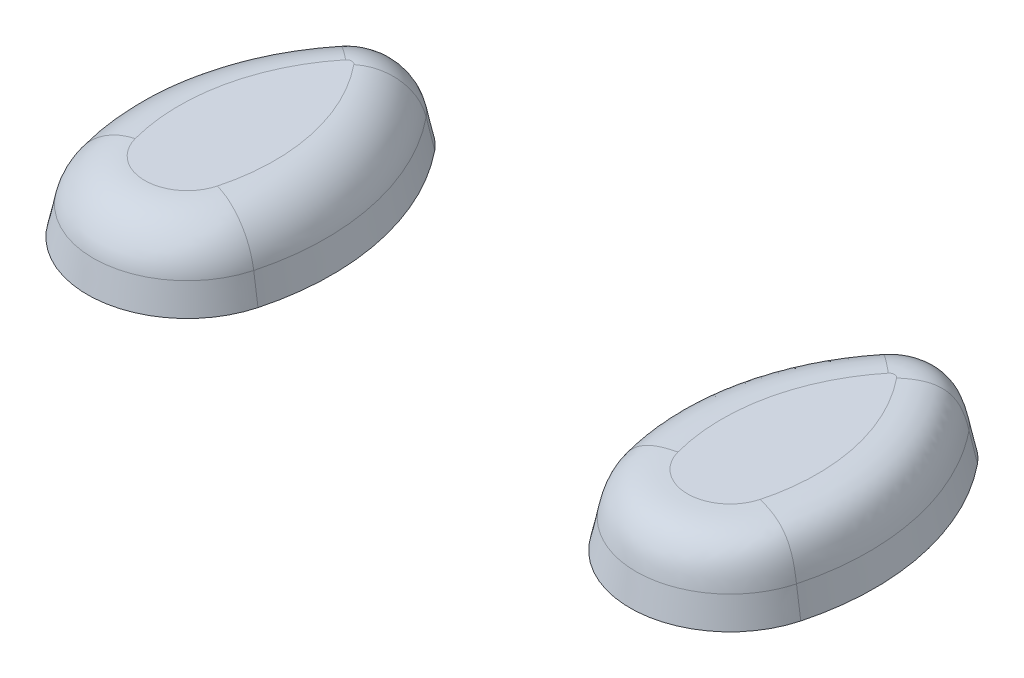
SolidWorks part; units mm, degrees
ref_plane "Front Plane" through (0, 0, 0) normal (0, 0, 1) x (1, 0, 0)
ref_plane "Top Plane" through (0, 0, 0) normal (0, 1, 0) x (1, 0, 0)
ref_plane "Right Plane" through (0, 0, 0) normal (1, 0, 0) x (0, 0, -1)
sketch "Sketch1" plane through (0, 0, 0) normal (0, 1, 0) x (1, 0, 0)
  line L0 (0, 0) -> (0, 69.4951) construction
  arc A0 (-17.6789, 44.5379) -> (17.6789, 44.5379) centre (0, 30.2081) cw
  arc A1 (17.6789, 44.5379) -> (34.9951, -36.8109) centre (-53.4568, -13.1217) cw
  arc A2 (34.9951, -36.8109) -> (-34.9951, -36.8109) centre (0, -27.4385) cw
  arc A3 (-17.6789, 44.5379) -> (-34.9951, -36.8109) centre (53.4568, -13.1217) ccw
extrude "Extrude1" add sketch "Sketch1" along normal blind 25.4 draft 12
ref_plane "Plane1" through (-98.3197, 0, 0) normal (1, 0, 0) x (0, 0, -1)
mirror "Mirror2" about plane through (-98.3197, 0, 0) normal (1, 0, 0)
fillet "Fillet2" radius 19.05 4 edges at (-227.4646, 25.4, -4.8188) (-196.6394, 25.4, -47.5663) (-165.8142, 25.4, -4.8188) (-196.6394, 25.4, 58.2681)
fillet "Fillet3" radius 19.05 8 edges at (30.8252, 25.4, -4.8188) (0, 25.4, -47.5663) (-30.8252, 25.4, -4.8188) (0, 25.4, 58.2681) (-15.5819, 12.7, -42.8381) (15.5819, 12.7, -42.8381) (32.3876, 12.7, 36.1126) (-32.3876, 12.7, 36.1126)
